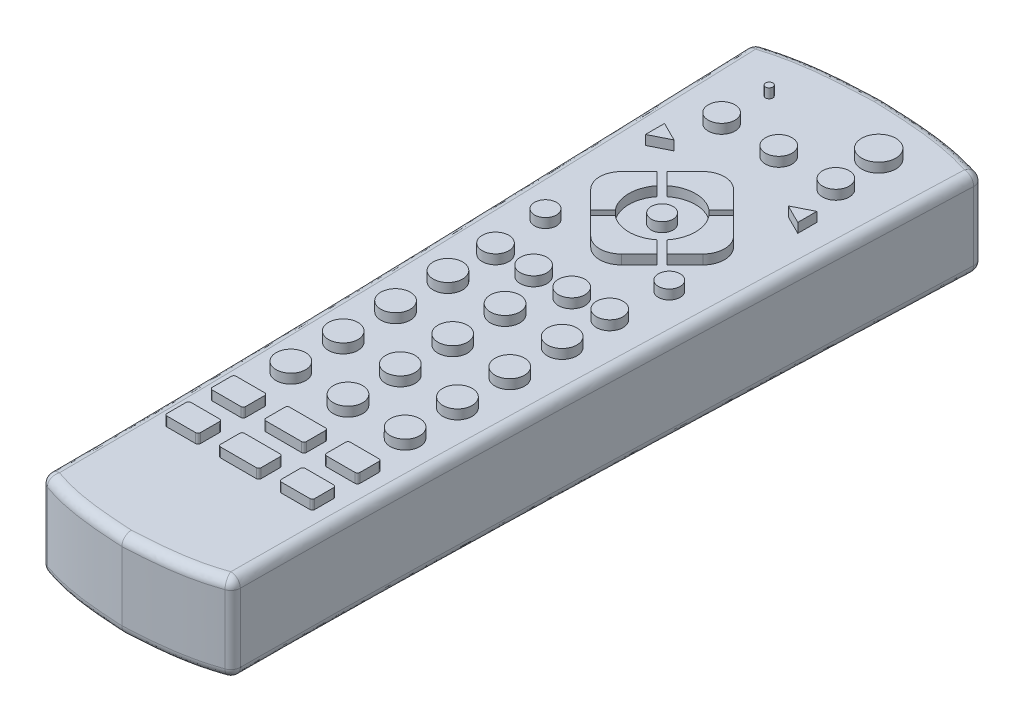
SolidWorks part; units mm, degrees
ref_plane "Plan de face" through (0, 0, 0) normal (0, 0, 1) x (1, 0, 0)
ref_plane "Plan de dessus" through (0, 0, 0) normal (0, 1, 0) x (1, 0, 0)
ref_plane "Plan de droite" through (0, 0, 0) normal (1, 0, 0) x (0, 0, -1)
sketch "Esquisse1" plane through (0, 0, 0) normal (0, 1, 0) x (1, 0, 0)
  line L0 (0, -31.2331) -> (0, 187.8895) construction
  line L1 (82.8532, 0) -> (-8.8319, 0) construction
  line L2 (-8.8319, 160) -> (82.8532, 160) construction
  line L3 (24, 187.8895) -> (24, 128.0044) construction
  line L4 (20, -31.2331) -> (20, 19.2884) construction
  line L5 (9.6508, 156.5) -> (43.7163, 156.5) construction
  line L6 (43.7163, 3.5) -> (9.6508, 3.5) construction
  spline S0 degree 3 poles (0, 160) (7.9558, 159.6962) (15.9116, 159.3924) (24, 156.5) knots 0 0 0 0 1 1 1 1
  spline S1 degree 3 poles (0, 0) (6.5454, 0.3811) (13.0908, 0.7621) (20, 3.5) knots 0 0 0 0 1 1 1 1
  spline S2 degree 3 poles (24, 156.5) (22.0148, 102.1379) (20.0296, 47.7758) (20, 3.5) knots 0 0 0 0 1 1 1 1
  spline S3 degree 3 poles (0, 160) (-7.9558, 159.6962) (-15.9116, 159.3924) (-24, 156.5) knots 0 0 0 0 1 1 1 1
  spline S4 degree 3 poles (-24, 156.5) (-22.0148, 102.1379) (-20.0296, 47.7758) (-20, 3.5) knots 0 0 0 0 1 1 1 1
  spline S5 degree 3 poles (0, 0) (-6.5454, 0.3811) (-13.0908, 0.7621) (-20, 3.5) knots 0 0 0 0 1 1 1 1
  dimension "D1" = 160
  dimension "D2" = 24
  dimension "D3" = 20
  dimension "D4" = 3.5
  dimension "D5" = 3.5
extrude "Extrusion1" add sketch "Esquisse1" along normal blind 18.4
sketch "Esquisse2" plane through (0, 18.4, 0) normal (0, 1, 0) x (-1, 0, 0)
  line L0 (0, 12.7204) -> (0, -164.9996) construction
  line L1 (61.3219, 0) -> (-66.6787, 0) construction
  line L2 (32.6609, -27) -> (-66.6787, -27) construction
  line L3 (32.6609, -36.5) -> (-66.6787, -36.5) construction
  line L4 (5.6167, -24.5) -> (-21.9597, -24.5) construction
  line L5 (5.6167, -29.5) -> (-21.9597, -29.5) construction
  line L6 (-4.25, -18.5145) -> (-4.25, -30.9781) construction
  line L7 (-8.5, -18.5145) -> (-8.5, -30.9781) construction
  line L8 (-15.5, -18.5145) -> (-15.5, -30.9781) construction
  line L9 (3.75, -29.5) -> (-3.75, -29.5)
  line L10 (15.5, -29) -> (15.5, -25)
  line L11 (-9, -29.5) -> (-15, -29.5)
  line L12 (-8.5, -29) -> (-8.5, -25)
  line L13 (-9, -24.5) -> (-15, -24.5)
  line L14 (-4.25, -29) -> (-4.25, -25)
  line L15 (-3.75, -24.5) -> (3.75, -24.5)
  line L16 (4.25, -29) -> (4.25, -25)
  line L17 (-15.5, -29) -> (-15.5, -25)
  line L18 (9, -24.5) -> (15, -24.5)
  line L19 (8.5, -29) -> (8.5, -25)
  line L20 (9, -29.5) -> (15, -29.5)
  line L21 (3.75, -39) -> (-3.75, -39)
  line L22 (15.5, -38.5) -> (15.5, -34.5)
  line L23 (-9, -39) -> (-15, -39)
  line L24 (-8.5, -38.5) -> (-8.5, -34.5)
  line L25 (-9, -34) -> (-15, -34)
  line L26 (-4.25, -38.5) -> (-4.25, -34.5)
  line L27 (-3.75, -34) -> (3.75, -34)
  line L28 (4.25, -38.5) -> (4.25, -34.5)
  line L29 (-15.5, -38.5) -> (-15.5, -34.5)
  line L30 (9, -34) -> (15, -34)
  line L31 (8.5, -38.5) -> (8.5, -34.5)
  line L32 (9, -39) -> (15, -39)
  line L33 (32.6609, -47.5) -> (-66.6787, -47.5) construction
  line L34 (-12, -166.9597) -> (-12, -7.0231) construction
  line L35 (-46.5013, -80.5) -> (32.6609, -80.5) construction
  line L36 (-46.5013, -90.5) -> (32.6609, -90.5) construction
  line L37 (32.6609, -128) -> (-33.6285, -128) construction
  line L38 (32.6609, -113.5) -> (-46.5013, -113.5) construction
  line L39 (-4, -73.525) -> (-4, -94.3472) construction
  line L40 (-13, -94.3472) -> (-13, -104.234) construction
  line L41 (-33.6285, -102) -> (-10.774, -102) construction
  line L42 (14.9813, -113.5) -> (-0.0093, -98.5093) construction
  line L43 (-0.0093, -128.4907) -> (-15, -113.5) construction
  line L44 (-15, -113.5) -> (-0.0093, -98.5093) construction
  line L45 (14.9813, -113.5) -> (-0.0093, -128.4907) construction
  line L46 (0, -113.5) -> (-9.5722, -123.0722) construction
  line L47 (-7.7995, -122.3602) -> (-3.6248, -118.1855) construction
  line L48 (-4.3909, -118.9516) -> (-6.9697, -121.5303)
  line L49 (-6.9697, -121.5303) -> (-3.2173, -125.2827)
  line L50 (4.3909, -118.9516) -> (6.9697, -121.5303)
  line L51 (6.9697, -121.5303) -> (3.2173, -125.2827)
  line L52 (-5.4516, -117.8909) -> (-8.0303, -120.4697)
  line L53 (-8.0303, -120.4697) -> (-11.7827, -116.7173)
  line L54 (-8.0303, -106.5303) -> (-11.7827, -110.2827)
  line L55 (-5.4516, -109.1091) -> (-8.0303, -106.5303)
  line L56 (-4.3909, -108.0484) -> (-6.9697, -105.4697)
  line L57 (-6.9697, -105.4697) -> (-3.2173, -101.7173)
  line L58 (6.9697, -105.4697) -> (3.2173, -101.7173)
  line L59 (4.3909, -108.0484) -> (6.9697, -105.4697)
  line L60 (5.4516, -109.1091) -> (8.0303, -106.5303)
  line L61 (8.0303, -106.5303) -> (11.7827, -110.2827)
  line L62 (8.0303, -120.4697) -> (11.7827, -116.7173)
  line L63 (5.4516, -117.8909) -> (8.0303, -120.4697)
  line L64 (32.6609, -138) -> (-33.6284, -138) construction
  line L65 (-16, -132.2695) -> (-16, -115.6936) construction
  line L66 (-25.819, -126) -> (-10.4369, -126) construction
  line L67 (-25.819, -130) -> (-10.4369, -130) construction
  line L68 (-11, -132.2695) -> (-11, -123.0722) construction
  line L69 (-16, -130) -> (-12, -128)
  line L70 (-12, -128) -> (-16, -126)
  line L71 (-16, -126) -> (-16, -130)
  line L72 (12, -128) -> (16, -126)
  line L73 (16, -130) -> (12, -128)
  line L74 (16, -126) -> (16, -130)
  line L75 (-33.6284, -148) -> (30.3407, -148) construction
  arc A0 (-15, -29.5) -> (-15.5, -29) centre (-15, -29) cw
  arc A1 (-15, -24.5) -> (-15.5, -25) centre (-15, -25) ccw
  arc A2 (-8.5, -25) -> (-9, -24.5) centre (-9, -25) ccw
  arc A3 (-9, -29.5) -> (-8.5, -29) centre (-9, -29) ccw
  arc A4 (-3.75, -29.5) -> (-4.25, -29) centre (-3.75, -29) cw
  arc A5 (-4.25, -25) -> (-3.75, -24.5) centre (-3.75, -25) cw
  arc A6 (4.25, -25) -> (3.75, -24.5) centre (3.75, -25) ccw
  arc A7 (3.75, -29.5) -> (4.25, -29) centre (3.75, -29) ccw
  arc A8 (9, -29.5) -> (8.5, -29) centre (9, -29) cw
  arc A9 (8.5, -25) -> (9, -24.5) centre (9, -25) cw
  arc A10 (15, -24.5) -> (15.5, -25) centre (15, -25) cw
  arc A11 (15, -29.5) -> (15.5, -29) centre (15, -29) ccw
  arc A12 (-15, -39) -> (-15.5, -38.5) centre (-15, -38.5) cw
  arc A13 (-15, -34) -> (-15.5, -34.5) centre (-15, -34.5) ccw
  arc A14 (-8.5, -34.5) -> (-9, -34) centre (-9, -34.5) ccw
  arc A15 (-9, -39) -> (-8.5, -38.5) centre (-9, -38.5) ccw
  arc A16 (-3.75, -39) -> (-4.25, -38.5) centre (-3.75, -38.5) cw
  arc A17 (-4.25, -34.5) -> (-3.75, -34) centre (-3.75, -34.5) cw
  arc A18 (4.25, -34.5) -> (3.75, -34) centre (3.75, -34.5) ccw
  arc A19 (3.75, -39) -> (4.25, -38.5) centre (3.75, -38.5) ccw
  arc A20 (9, -39) -> (8.5, -38.5) centre (9, -38.5) cw
  arc A21 (8.5, -34.5) -> (9, -34) centre (9, -34.5) cw
  arc A22 (15, -34) -> (15.5, -34.5) centre (15, -34.5) cw
  arc A23 (15, -39) -> (15.5, -38.5) centre (15, -38.5) ccw
  circle A24 centre (0, -47.5) radius 3.1
  circle A25 centre (-12, -47.5) radius 3.1
  circle A26 centre (12, -47.5) radius 3.1
  circle A27 centre (0, -58.5) radius 3.1
  circle A28 centre (-12, -58.5) radius 3.1
  circle A29 centre (12, -58.5) radius 3.1
  circle A30 centre (0, -69.5) radius 3.1
  circle A31 centre (-12, -69.5) radius 3.1
  circle A32 centre (12, -69.5) radius 3.1
  circle A33 centre (0, -80.5) radius 3.1
  circle A34 centre (-12, -80.5) radius 3.1
  circle A35 centre (12, -80.5) radius 3.1
  circle A36 centre (-12, -90.5) radius 2.8
  circle A37 centre (-4, -90.5) radius 2.8
  circle A38 centre (12, -90.5) radius 2.8
  circle A39 centre (4, -90.5) radius 2.8
  circle A40 centre (-13, -102) radius 2.3
  circle A41 centre (0, -113.5) radius 2.3
  arc A42 (-11.7827, -110.2827) -> (-11.7827, -116.7173) centre (-8.5653, -113.5) ccw
  arc A43 (-3.2173, -125.2827) -> (3.2173, -125.2827) centre (0, -122.0653) ccw
  arc A44 (-5.4516, -109.1091) -> (-5.4516, -117.8909) centre (0, -113.5) ccw
  arc A45 (-4.3909, -118.9516) -> (4.3909, -118.9516) centre (0, -113.5) ccw
  arc A46 (3.2173, -101.7173) -> (-3.2173, -101.7173) centre (0, -104.9347) ccw
  arc A47 (4.3909, -108.0484) -> (-4.3909, -108.0484) centre (0, -113.5) ccw
  arc A48 (11.7827, -116.7173) -> (11.7827, -110.2827) centre (8.5653, -113.5) ccw
  arc A49 (5.4516, -117.8909) -> (5.4516, -109.1091) centre (0, -113.5) ccw
  circle A50 centre (13, -102) radius 2.3
  circle A51 centre (-12, -138) radius 2.8
  circle A52 centre (0, -138) radius 2.8
  circle A53 centre (12, -138) radius 2.8
  circle A54 centre (-11, -148) radius 3.6
  circle A55 centre (12, -148) radius 0.75
  dimension "D7" = 11
  dimension "D8" = 12
  dimension "D10" = 10
  dimension "D11" = 4
  dimension "D12" = 13
  dimension "D14" = 90
  dimension "D19" = 26
  dimension "D21" = 16
  dimension "D1" = 27
  dimension "D2" = 9.5
  dimension "D3" = 7
  dimension "D4" = 5
  dimension "D5" = 4.25
  dimension "D6" = 2.5
  dimension "D9" = 3.5
  dimension "D13" = 23
  dimension "D15" = 21.2
  dimension "D16" = 21.2
  dimension "D17" = 45
  dimension "D18" = 0.75
  dimension "D20" = 10
  dimension "D22" = 5
  dimension "D23" = 2
  dimension "D24" = 4
  dimension "D25" = 10
extrude "Extrusion2" add sketch "Esquisse2" along normal blind 2
fillet "Congé1" radius 2 16 edges at (20, 9.2, -3.5) (-20, 9.2, -3.5) (-24, 9.2, -156.5) (24, 9.2, -156.5)
